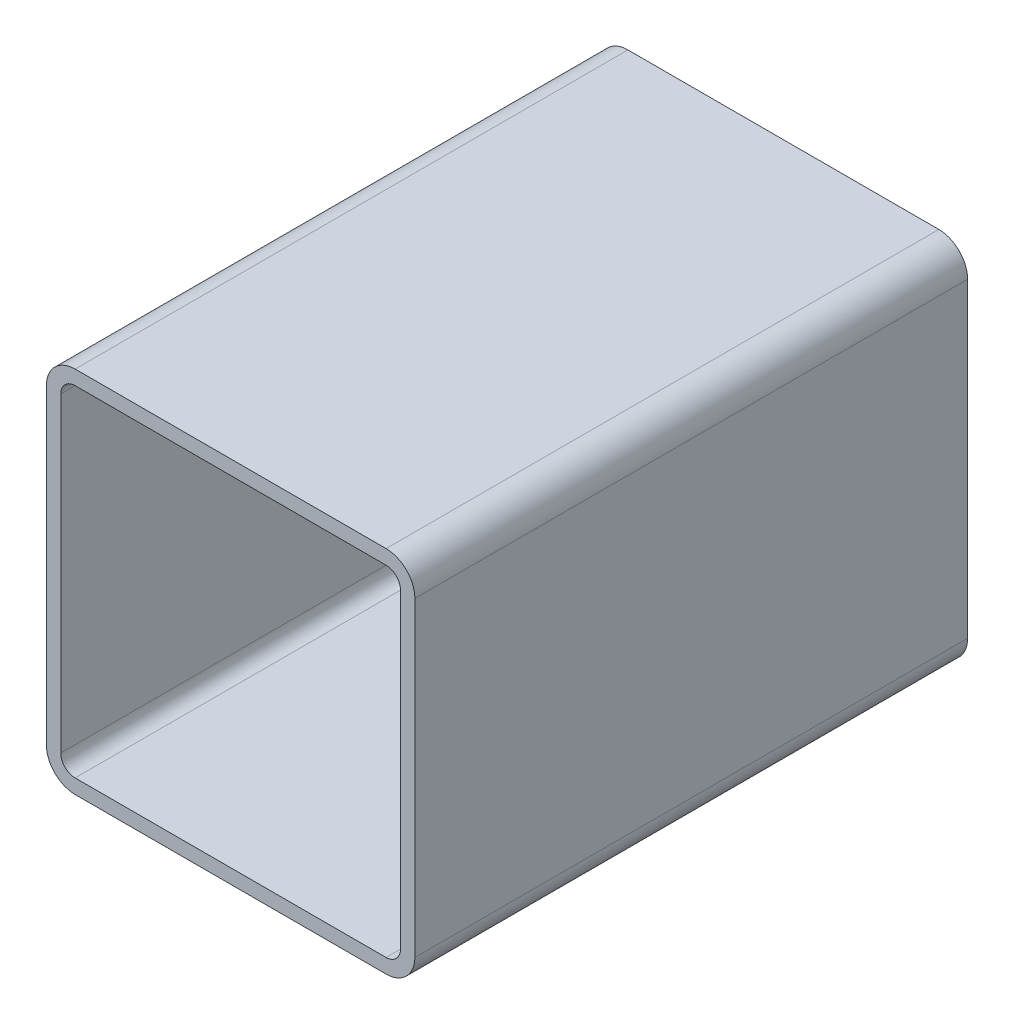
SolidWorks part; units mm, degrees
ref_plane "Front Plane" through (0, 0, 0) normal (0, 0, 1) x (1, 0, 0)
ref_plane "Top Plane" through (0, 0, 0) normal (0, 1, 0) x (1, 0, 0)
ref_plane "Right Plane" through (0, 0, 0) normal (1, 0, 0) x (0, 0, -1)
sketch "Sketch1" plane through (0, 0, 0) normal (0, 0, 1) x (1, 0, 0)
sketch_block_instance "HSS8x8x0.3125-1"
sketch_block "HSS8x8x0.3125"
extrude "Boss-Extrude1" add sketch "Sketch1" along normal blind 304.8
